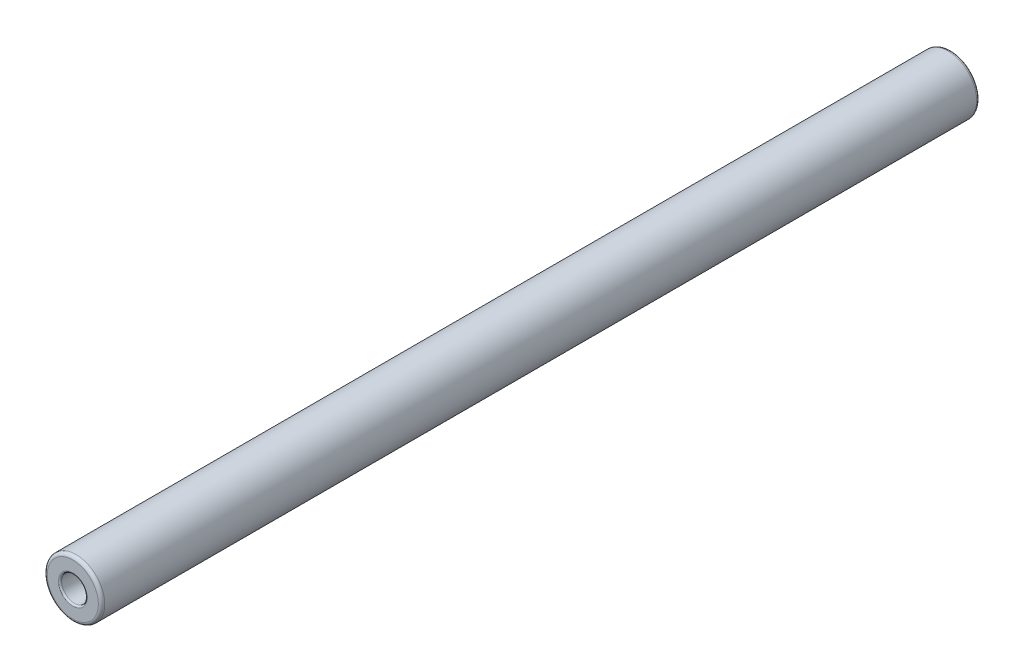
SolidWorks part; units mm, degrees
ref_plane "Piano frontale" through (0, 0, 0) normal (0, 0, 1) x (1, 0, 0)
ref_plane "Piano superiore" through (0, 0, 0) normal (0, 1, 0) x (1, 0, 0)
ref_plane "Piano destro" through (0, 0, 0) normal (1, 0, 0) x (0, 0, -1)
sketch "Schizzo1" plane through (0, 0, 0) normal (0, 0, 1) x (1, 0, 0)
  circle A0 centre (0, 0) radius 18
  dimension "D1" = 36
sketch "Schizzo2" plane through (0, 0, 0) normal (1, 0, 0) x (0, 0, -1)
  line L0 (0, 0) -> (550, 0)
  dimension "D1" = 550
sweep "Sweep1" add profiles "Schizzo1" path "Schizzo2"
sketch "Schizzo3" plane through (0, 0, -550) normal (0, 0, -1) x (-1, 0, 0)
  circle A0 centre (0, 0) radius 12
  circle A1 centre (0, 0) radius 18
  circle A2 centre (0, 0) radius 18 construction
  dimension "D1" = 24
extrude "Taglio-Estrusione1" [suppressed] cut sketch "Schizzo3" against normal blind 70
sketch "Schizzo5" plane through (0, 0, 0) normal (0, 0, 1) x (1, 0, 0)
  circle A1 centre (0, 0) radius 18
  circle A2 centre (0, 0) radius 18
  circle A3 centre (0, 0) radius 12
  circle A4 centre (0, 0) radius 12
  dimension "D1" = 0
  dimension "D2" = 0
extrude "Taglio-Estrusione2" [suppressed] cut sketch "Schizzo5" against normal blind 70
fillet "Raccordo1" radius 2 2 edges at (18, 0, 0) (18, 0, -550)
sketch "Schizzo7" plane through (0, 0, 0) normal (0, 0, 1) x (1, 0, 0)
  circle A0 centre (0, 0) radius 8
  dimension "D1" = 16
extrude "Taglio-Estrusione3" cut sketch "Schizzo7" against normal blind 70
sketch "Schizzo11" plane through (0, 0, -550) normal (0, 0, -1) x (-1, 0, 0)
  circle A1 centre (0, 0) radius 8
  circle A2 centre (0, 0) radius 8
  dimension "D1" = 0
extrude "Taglio-Estrusione4" cut sketch "Schizzo11" against normal blind 70
fillet "Raccordo2" radius 1 2 edges at (8, 0, 0) (-8, 0, -550)
ref_plane "Piano1" through (0, 0, -275) normal (0, 0, 1) x (1, 0, 0)
sketch "Linee di piegatura1" [suppressed] plane through (0, 0, 0) normal (0, 1, 0) x (1, 0, 0)
sketch "Casella di contorno1" [suppressed] plane through (0, 0, 0) normal (0, 1, 0) x (1, 0, 0)
equation "\"Lam_vern\"= 2 * ( \"SW-Massa\" / \"SW-Densità\" ) / ( \"Spessore\" / 1000 )"
